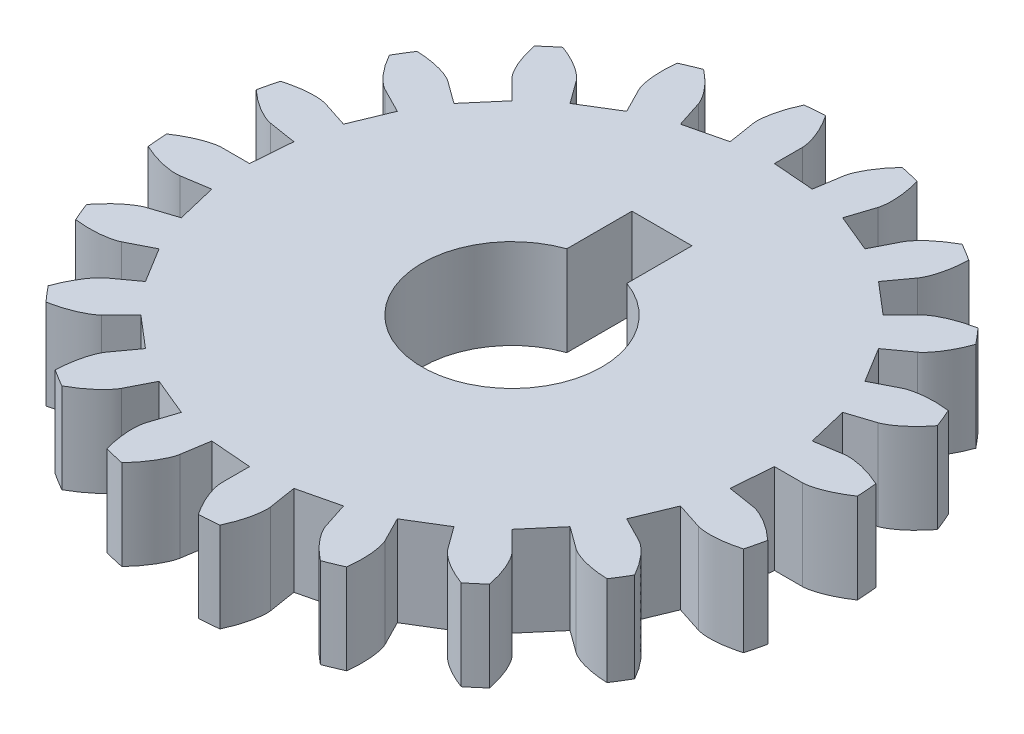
SolidWorks part; units mm, degrees
ref_plane "Front Plane" through (0, 0, 0) normal (0, 0, 1) x (1, 0, 0)
ref_plane "Top Plane" through (0, 0, 0) normal (0, 1, 0) x (1, 0, 0)
ref_plane "Right Plane" through (0, 0, 0) normal (1, 0, 0) x (0, 0, -1)
sketch "Sketch1" plane through (0, 0, 0) normal (0, 1, 0) x (1, 0, 0)
  line L0 (0, 0) -> (0, 4.8407) construction
  line L1 (0, 0) -> (-4.8407, 0) construction
  line L2 (0, 0) -> (-5.483, -0.4315) construction
  line L3 (0, 0) -> (-4.7811, -0.7573) construction
  line L4 (0, 0) -> (-4.6038, -1.4959) construction
  circle A0 centre (0, 0) radius 5 construction
  circle A1 centre (0, 0) radius 4.8407 construction
  circle A2 centre (0, 0) radius 4.375 construction
  circle A3 centre (0, 0) radius 5.5 construction
  spline S0 degree 4 poles (-4.8407, 0) (-4.8474, 0) (-4.8659, -0.0007) (-4.9009, -0.0047) (-4.9574, -0.0149) (-5.0284, -0.0335) (-5.1183, -0.0638) (-5.2217, -0.1073) (-5.332, -0.1631) (-5.4477, -0.2321) (-5.5592, -0.3081) (-5.6661, -0.3904) (-5.7687, -0.4779) (-5.8878, -0.5902) (-6.0234, -0.7336) (-6.1702, -0.9127) (-6.3225, -1.1288) (-6.4613, -1.3614) (-6.584, -1.5999) (-6.6914, -1.8504) (-6.7833, -2.0993) (-6.8608, -2.3655) (-6.9232, -2.6153) (-6.9727, -2.9014) (-7.0067, -3.1344) (-7.0294, -3.4466) (-7.0362, -3.6323) (-7.0364, -3.8507) (-7.0325, -3.9482) (-7.0302, -4.0081) knots 0 0 0 0 0 0.005377 0.015084 0.028532 0.04661 0.064855 0.092111 0.119476 0.146842 0.174209 0.201575 0.228941 0.256307 0.307035 0.361767 0.4165 0.471232 0.525964 0.580697 0.635429 0.690161 0.744894 0.799626 0.854358 0.909091 0.954545 1 1 1 1 1 construction
  spline S1 degree 4 poles (-4.8407, 0) (-4.8474, 0) (-4.8659, -0.0007) (-4.9009, -0.0047) (-4.9574, -0.0149) (-5.0284, -0.0335) (-5.1183, -0.0638) (-5.2217, -0.1073) (-5.332, -0.1631) (-5.4477, -0.2321) (-5.5592, -0.3081) (-5.6661, -0.3904) (-5.7687, -0.4779) (-5.8878, -0.5902) (-6.0234, -0.7336) (-6.1702, -0.9127) (-6.3225, -1.1288) (-6.4613, -1.3614) (-6.584, -1.5999) (-6.6914, -1.8504) (-6.7833, -2.0993) (-6.8608, -2.3655) (-6.9232, -2.6153) (-6.9727, -2.9014) (-7.0067, -3.1344) (-7.0244, -3.3789) (-7.0305, -3.4984) (-7.0326, -3.5597) knots 0 0 0 0 0 0.005377 0.015084 0.028532 0.04661 0.064855 0.092111 0.119476 0.146842 0.174209 0.201575 0.228941 0.256307 0.307035 0.361767 0.4165 0.471232 0.525964 0.580697 0.635429 0.690161 0.744894 0.799626 0.854358 0.909091 0.909091 0.909091 0.909091 0.909091
  dimension "D1" = 11
  dimension "D2" = 10
  dimension "D3" = 9.6815
  dimension "D4" = 8.75
  dimension "D5" = 4.8407
  dimension "D6" = 4.5
  dimension "D7" = 9
  dimension "D8" = 18
sketch "Sketch2" plane through (0, 0, 0) normal (0, 1, 0) x (1, 0, 0)
  line L0 (0, 0) -> (-5.483, -0.4315) construction
  line L1 (0, 0) -> (-5.483, -0.4315) construction
  line L2 (0, 0) -> (-4.7811, -0.7573) construction
  line L3 (0, 0) -> (-4.8407, 0) construction
  line L4 (0, 0) -> (-4.6038, -1.4959) construction
  line L5 (0, 0) -> (-4.7811, -0.7573) construction
  line L6 (0, 0) -> (-4.8407, 0) construction
  line L7 (0, 0) -> (-4.6038, -1.4959) construction
  line L8 (-4.7811, -0.7573) -> (-4.3211, -0.6844)
  line L9 (-4.3211, -0.6844) -> (-4.1609, -1.3519)
  line L10 (-4.1609, -1.3519) -> (-4.6038, -1.4959) construction
  line L11 (-4.1609, -1.3519) -> (-1.4266, -0.4635)
  line L12 (-4.8407, 0) -> (-1.5, 0)
  circle A0 centre (0, 0) radius 4.375 construction
  circle A1 centre (0, 0) radius 4.8407 construction
  circle A2 centre (0, 0) radius 5 construction
  circle A3 centre (0, 0) radius 5.5 construction
  circle A4 centre (0, 0) radius 4.375 construction
  circle A5 centre (0, 0) radius 4.8407 construction
  circle A6 centre (0, 0) radius 5 construction
  circle A7 centre (0, 0) radius 5.5 construction
  arc A8 (-5.4674, -0.5984) -> (-5.4936, -0.2643) centre (0, 0) cw
  circle A11 centre (0, 0) radius 1.5 construction
  arc A12 (-1.5, 0) -> (-1.4266, -0.4635) centre (0, 0) ccw
  spline S0 degree 4 poles (-36.048, -999.5091) (-3.6686, -18.0791) (-3.7958, -0.3555) (-4.4091, 0.0848) (-4.9574, -0.0149) (-5.0284, -0.0335) (-5.1183, -0.0638) (-5.2217, -0.1073) (-5.332, -0.1631) (-5.4477, -0.2321) (-5.5592, -0.3081) (-5.6661, -0.3904) (-5.7687, -0.4779) (-5.8878, -0.5902) (-6.0234, -0.7336) (-6.1702, -0.9127) (-6.3225, -1.1288) (-6.4613, -1.3614) (-6.584, -1.5999) (-6.6914, -1.8504) (-6.7833, -2.0993) (-6.8608, -2.3655) (-6.9232, -2.6153) (-6.9727, -2.9014) (-7.1264, -3.9552) (-7.0221, -7.216) (-5.4794, 26.5273) (-39.1777, -1003.0309) knots -0.405639 -0.405639 -0.405639 -0.405639 -0.405639 0.005377 0.015084 0.028532 0.04661 0.064855 0.092111 0.119476 0.146842 0.174209 0.201575 0.228941 0.256307 0.307035 0.361767 0.4165 0.471232 0.525964 0.580697 0.635429 0.690161 0.744894 0.799626 0.854358 1.680403 1.680403 1.680403 1.680403 1.680403 only from (-4.8407, 0) to (-7.0326, -3.5597) construction
  spline S1 degree 4 poles (-4.8407, 0) (-4.8474, 0) (-4.8659, -0.0007) (-4.9009, -0.0047) (-4.9574, -0.0149) (-5.0284, -0.0335) (-5.1183, -0.0638) (-5.2217, -0.1073) (-5.3294, -0.1618) (-5.4139, -0.2119) (-5.4681, -0.247) (-5.4936, -0.2643) knots 0 0 0 0 0 0.005377 0.015084 0.028532 0.04661 0.064855 0.092111 0.119476 0.144531 0.144531 0.144531 0.144531 0.144531
  spline S2 degree 4 poles (-4.7811, -0.7573) (-4.7877, -0.7583) (-4.8061, -0.7605) (-4.8413, -0.7621) (-4.8987, -0.7608) (-4.9717, -0.7535) (-5.0653, -0.7377) (-5.1742, -0.7109) (-5.2891, -0.6739) (-5.3804, -0.6376) (-5.4394, -0.6114) (-5.4674, -0.5984) knots 0 0 0 0 0 0.005377 0.015084 0.028532 0.04661 0.064855 0.092111 0.119476 0.144531 0.144531 0.144531 0.144531 0.144531
  point P21 (-4.3211, -0.6844)
  point P24 (-4.1609, -1.3519)
  dimension "D2" = 3
extrude "Boss-Extrude1" add sketch "Sketch2" along normal blind 1.5
pattern_circular "CirPattern1" count 20 over 360 of "Boss-Extrude1"
sketch "Sketch3" plane through (0, 1.5, 0) normal (0, 1, 0) x (1, 0, 0)
  line L1 (0.5, 0.5) -> (-0.5, 0.5)
  line L2 (0.5, 0.5) -> (0.5, 2.5)
  line L3 (0.5, 2.5) -> (-0.5, 2.5)
  line L4 (-0.5, 0.5) -> (-0.5, 2.5)
  line L5 (0.5, 0.5) -> (-0.5, 2.5) construction
  line L6 (0.5, 2.5) -> (-0.5, 0.5) construction
  circle A0 centre (0, 0) radius 1.5 construction
  point P0 (0, 1.5)
  dimension "D1" = 2
  dimension "D2" = 1
extrude "Cut-Extrude1" cut sketch "Sketch3" against normal up to surface (1.5 mm away)
equation "\"Module\"= .5"
equation "\"Number of Teeth\" = 20"
equation "\"Pressure Angle\"= 14.5deg"
equation "\"Pitch Diameter\"= \"Number of Teeth\" * \"Module\""
equation "\"Circular Pitch\"= pi * \"Module\""
equation "\"Addendum\"= \"Module\""
equation "\"Dedendum\"= 1.25 * \"Module\""
equation "\"Base Diameter\"= \"Pitch Diameter\" * cos ( \"Pressure Angle\" )"
equation "\"Base Radius\"= \"Base Diameter\" / 2"
equation "\"Width\"= 1.5"
equation "\"Outside Diameter\"= \"Pitch Diameter\" + 2 * \"Addendum\""
equation "\"D1@Sketch1\"=\"Outside Diameter\""
equation "\"D3@Sketch1\"=\"Base Diameter\""
equation "\"Root Diameter\"= \"Pitch Diameter\" - 2 * \"Dedendum\""
equation "\"D4@Sketch1\"=\"Root Diameter\""
equation "\"Tooth Angle\"= 360 / \"Number of Teeth\""
equation "\"D6@Sketch1\"=\"Tooth Angle\"/4"
equation "\"D7@Sketch1\"=\"Tooth Angle\"/2"
equation "\"D8@Sketch1\"=\"Tooth Angle\""
equation "\"D2@Sketch1\" = \"Pitch Diameter\""
equation "\"Shaft Diameter\"= 3"
equation "\"D1@CirPattern1\" = \"Number of Teeth\""
equation "\"D2@Sketch2\"= \"Shaft Diameter\""
equation "\"D1@Boss-Extrude1\" = \"Width\""
